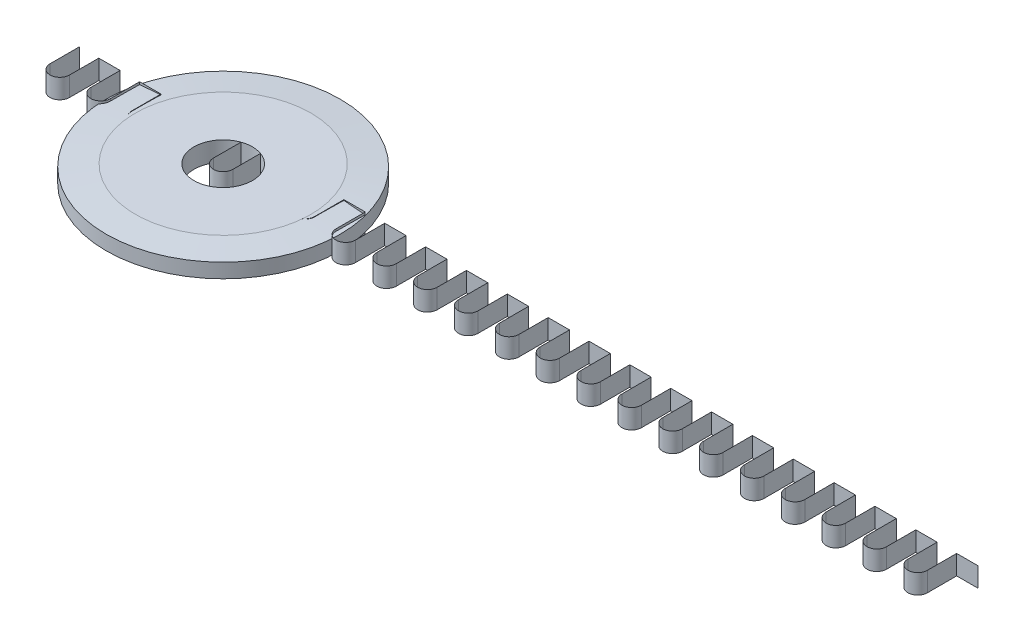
SolidWorks part; units mm, degrees
other "Abbildungsoberflaechenkoerper"
other "Detailelement1"
ref_plane "Vorne" through (0, 0, 0) normal (0, 0, 1) x (1, 0, 0)
ref_plane "Oben" through (0, 0, 0) normal (0, 1, 0) x (1, 0, 0)
ref_plane "Rechts" through (0, 0, 0) normal (1, 0, 0) x (0, 0, -1)
sketch "Skizze1" plane through (0, 0, 0) normal (0, 0, 1) x (1, 0, 0)
  line L0 (0, 0) -> (0, 19.7529) construction
  line L1 (15, 0) -> (45, 0)
  line L2 (15, 0) -> (15, 10)
  line L3 (15, 10) -> (45, 10)
  line L4 (60, 1.3123) -> (60, 8.6877)
  line L5 (45, 10) -> (60, 8.6877)
  line L6 (45, 0) -> (60, 1.3123)
  dimension "D1" = 10
  dimension "D2" = 30
  dimension "D3" = 120
  dimension "D4" = 5
  dimension "D5" = 5
  dimension "D6" = 15
revolve "Rotation1" add sketch "Skizze1" angle 360 about L0
sketch "Skizze2" plane through (0, 0, 0) normal (0, 1, 0) x (1, 0, 0)
  line L0 (-78.7758, 0) -> (-78.7758, 15)
  line L1 (-88.7758, 0) -> (-88.7758, 15)
  line L2 (-67.8319, 0) -> (-67.8319, 15) construction
  line L3 (-67.8319, 0) -> (-67.8319, 15)
  line L4 (-78.7758, 15) -> (-67.8319, 15)
  line L5 (-57.8319, 15) -> (-46.8879, 15)
  line L6 (-57.8319, 0) -> (-57.8319, 15)
  line L7 (-46.8879, 0) -> (-46.8879, 15)
  line L8 (-36.8879, 15) -> (-25.944, 15)
  line L9 (-36.8879, 0) -> (-36.8879, 15)
  line L10 (-25.944, 0) -> (-25.944, 15)
  line L11 (-15.944, 15) -> (-5, 15)
  line L12 (-15.944, 0) -> (-15.944, 15)
  line L13 (-5, 0) -> (-5, 15)
  line L14 (5, 15) -> (15.944, 15)
  line L15 (5, 0) -> (5, 15)
  line L16 (15.944, 0) -> (15.944, 15)
  line L17 (25.944, 15) -> (36.8879, 15)
  line L18 (25.944, 0) -> (25.944, 15)
  line L19 (36.8879, 0) -> (36.8879, 15)
  line L20 (46.8879, 15) -> (57.8319, 15)
  line L21 (46.8879, 0) -> (46.8879, 15)
  line L22 (57.8319, 0) -> (57.8319, 15)
  line L23 (67.8319, 15) -> (78.7758, 15)
  line L24 (67.8319, 0) -> (67.8319, 15)
  line L25 (78.7758, 0) -> (78.7758, 15)
  line L26 (88.7758, 15) -> (99.7198, 15)
  line L27 (88.7758, 0) -> (88.7758, 15)
  line L28 (99.7198, 0) -> (99.7198, 15)
  line L29 (109.7198, 15) -> (120.6637, 15)
  line L30 (109.7198, 0) -> (109.7198, 15)
  line L31 (120.6637, 0) -> (120.6637, 15)
  line L32 (130.6637, 15) -> (141.6077, 15)
  line L33 (130.6637, 0) -> (130.6637, 15)
  line L34 (141.6077, 0) -> (141.6077, 15)
  line L35 (151.6077, 15) -> (162.5516, 15)
  line L36 (151.6077, 0) -> (151.6077, 15)
  line L37 (162.5516, 0) -> (162.5516, 15)
  line L38 (172.5516, 15) -> (183.4956, 15)
  line L39 (172.5516, 0) -> (172.5516, 15)
  line L40 (183.4956, 0) -> (183.4956, 15)
  line L41 (193.4956, 15) -> (204.4395, 15)
  line L42 (193.4956, 0) -> (193.4956, 15)
  line L43 (204.4395, 0) -> (204.4395, 15)
  line L44 (214.4395, 15) -> (225.3835, 15)
  line L45 (214.4395, 0) -> (214.4395, 15)
  line L46 (225.3835, 0) -> (225.3835, 15)
  line L47 (235.3835, 15) -> (246.3274, 15)
  line L48 (235.3835, 0) -> (235.3835, 15)
  line L49 (246.3274, 0) -> (246.3274, 15)
  line L50 (256.3274, 15) -> (267.2714, 15)
  line L51 (256.3274, 0) -> (256.3274, 15)
  line L52 (267.2714, 0) -> (267.2714, 15)
  line L53 (277.2714, 15) -> (288.2153, 15)
  line L54 (277.2714, 0) -> (277.2714, 15)
  line L55 (288.2153, 0) -> (288.2153, 15)
  line L56 (298.2153, 15) -> (309.1593, 15)
  line L57 (298.2153, 0) -> (298.2153, 15)
  line L58 (309.1593, 0) -> (309.1593, 15)
  line L59 (319.1593, 15) -> (330.1032, 15)
  line L60 (319.1593, 0) -> (319.1593, 15)
  line L61 (330.1032, 0) -> (330.1032, 15)
  line L62 (340.1032, 15) -> (351.0472, 15)
  line L63 (340.1032, 0) -> (340.1032, 15)
  line L64 (351.0472, 0) -> (351.0472, 15)
  line L65 (361.0472, 15) -> (371.9911, 15)
  line L66 (361.0472, 0) -> (361.0472, 15)
  line L67 (-83.7758, 0) -> (104.7198, 0) construction
  line L68 (0, 22.3556) -> (0, -21.3327) construction
  line L69 (0, -5.5) -> (0, 5.5) construction
  arc A0 (-88.7758, 0) -> (-78.7758, 0) centre (-83.7758, 0) ccw
  arc A1 (-67.8319, 0) -> (-57.8319, 0) centre (-62.8319, 0) ccw construction
  arc A2 (-67.8319, 0) -> (-57.8319, 0) centre (-62.8319, 0) ccw
  arc A3 (-46.8879, 0) -> (-36.8879, 0) centre (-41.8879, 0) ccw
  arc A4 (-25.944, 0) -> (-15.944, 0) centre (-20.944, 0) ccw
  arc A5 (-5, 0) -> (5, 0) centre (0, 0) ccw
  arc A6 (15.944, 0) -> (25.944, 0) centre (20.944, 0) ccw
  arc A7 (36.8879, 0) -> (46.8879, 0) centre (41.8879, 0) ccw
  arc A8 (57.8319, 0) -> (67.8319, 0) centre (62.8319, 0) ccw
  arc A9 (78.7758, 0) -> (88.7758, 0) centre (83.7758, 0) ccw
  arc A10 (99.7198, 0) -> (109.7198, 0) centre (104.7198, 0) ccw
  arc A11 (120.6637, 0) -> (130.6637, 0) centre (125.6637, 0) ccw
  arc A12 (141.6077, 0) -> (151.6077, 0) centre (146.6077, 0) ccw
  arc A13 (162.5516, 0) -> (172.5516, 0) centre (167.5516, 0) ccw
  arc A14 (183.4956, 0) -> (193.4956, 0) centre (188.4956, 0) ccw
  arc A15 (204.4395, 0) -> (214.4395, 0) centre (209.4395, 0) ccw
  arc A16 (225.3835, 0) -> (235.3835, 0) centre (230.3835, 0) ccw
  arc A17 (246.3274, 0) -> (256.3274, 0) centre (251.3274, 0) ccw
  arc A18 (267.2714, 0) -> (277.2714, 0) centre (272.2714, 0) ccw
  arc A19 (288.2153, 0) -> (298.2153, 0) centre (293.2153, 0) ccw
  arc A20 (309.1593, 0) -> (319.1593, 0) centre (314.1593, 0) ccw
  arc A21 (330.1032, 0) -> (340.1032, 0) centre (335.1032, 0) ccw
  arc A22 (351.0472, 0) -> (361.0472, 0) centre (356.0472, 0) ccw
  dimension "D1" = 10
  dimension "D3" = 20.944
  dimension "D4" = 15
  dimension "D2" = 22
surface "Oberfläche-Linear austragen2" sketch "Skizze2" parameters "D1"=10
